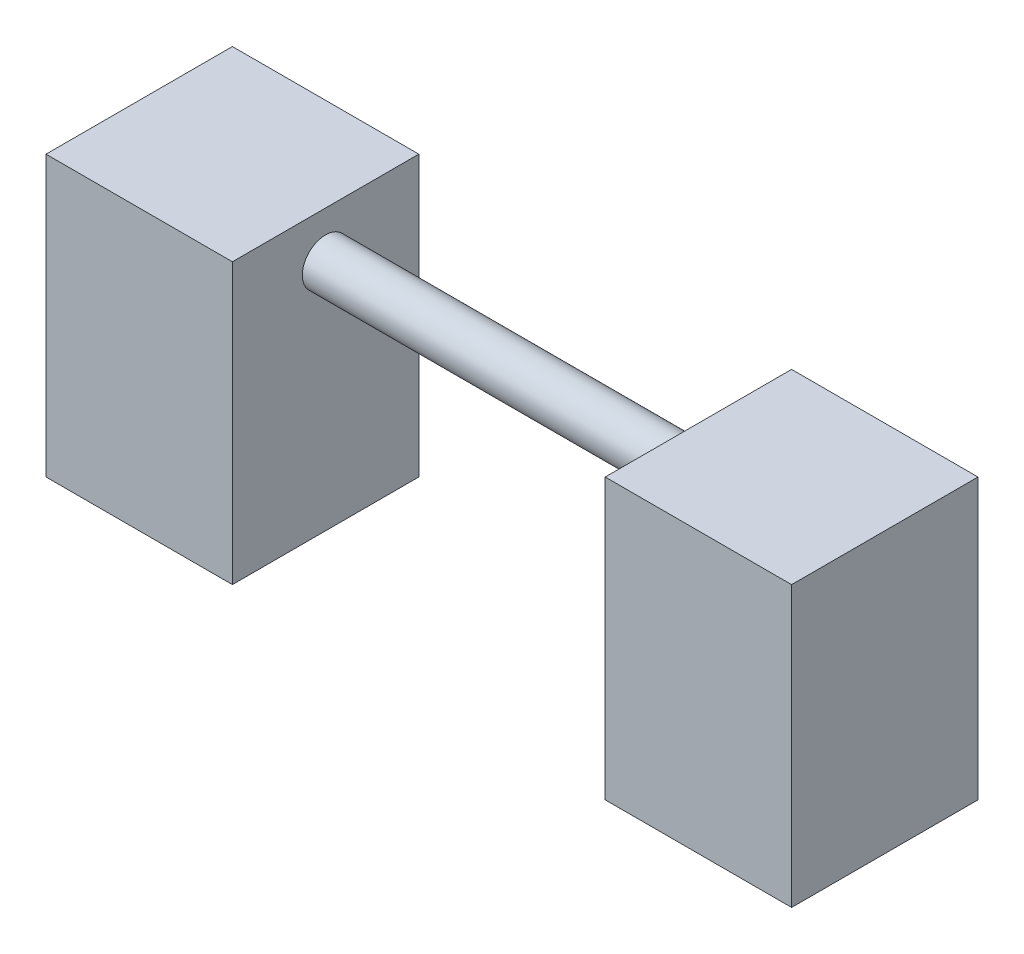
SolidWorks part; units mm, degrees
ref_plane "Front Plane" through (0, 0, 0) normal (0, 0, 1) x (1, 0, 0)
ref_plane "Top Plane" through (0, 0, 0) normal (0, 1, 0) x (1, 0, 0)
ref_plane "Right Plane" through (0, 0, 0) normal (1, 0, 0) x (0, 0, -1)
sketch "Sketch1" plane through (0, 0, 0) normal (0, 1, 0) x (1, 0, 0)
  line L0 (0, 67.0588) -> (0, -67.0588) construction
  line L1 (40, 20) -> (80, -20) construction
  line L2 (-40, -20) -> (-80, -20)
  line L3 (-40, -20) -> (-40, 20)
  line L4 (-40, 20) -> (-80, 20)
  line L5 (-80, -20) -> (-80, 20)
  line L6 (-40, -20) -> (-80, 20) construction
  line L7 (-40, 20) -> (-80, -20) construction
  line L8 (40, -20) -> (80, 20) construction
  line L9 (80, -20) -> (80, 20)
  line L10 (40, 20) -> (80, 20)
  line L11 (40, -20) -> (40, 20)
  line L12 (40, -20) -> (80, -20)
  point P3 (-60, 0)
  point P13 (60, 0)
  dimension "D1" = 40
  dimension "D2" = 60
extrude "Boss-Extrude1" add sketch "Sketch1" along normal blind 60
sketch "Sketch2" plane through (0, 0, 0) normal (1, 0, 0) x (0, 0, -1)
  line L0 (-20, 0) -> (20, 0) construction
  circle A0 centre (0, 50) radius 5
  dimension "D1" = 10
  dimension "D2" = 50
extrude "Boss-Extrude2" add sketch "Sketch2" along normal up to next (80 mm away) and the other way up to next (40 mm away)
